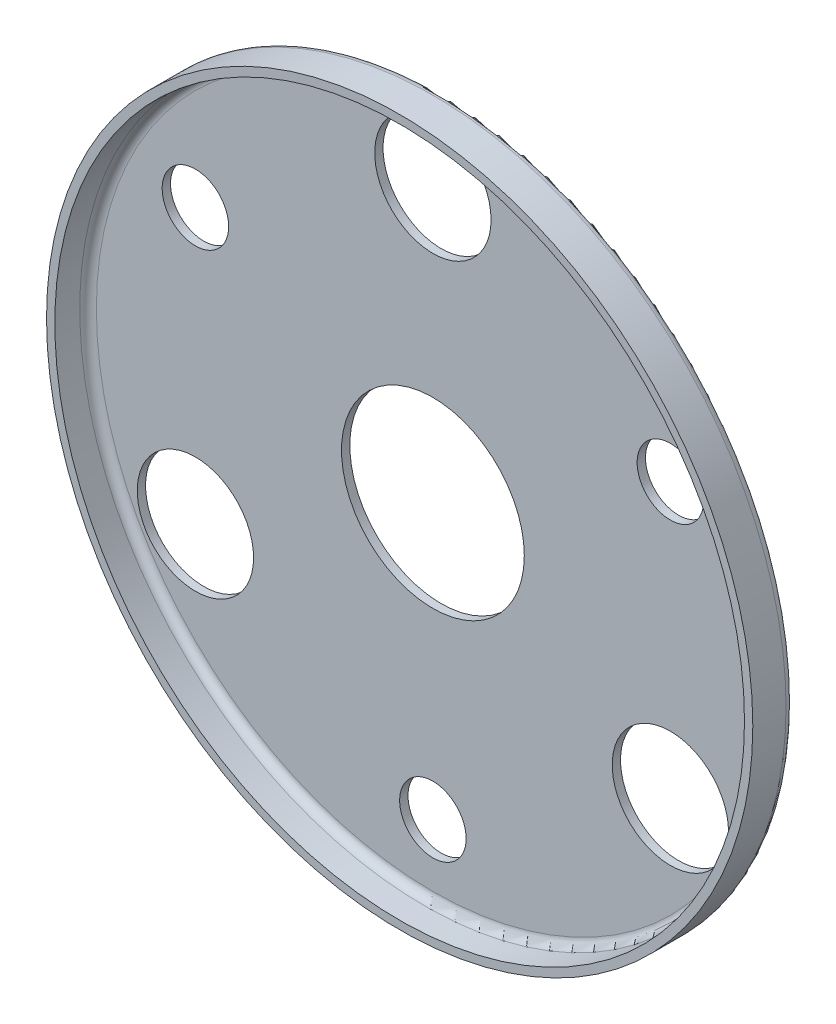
SolidWorks part; units mm, degrees
ref_plane "Plan de face" through (0, 0, 0) normal (0, 0, 1) x (1, 0, 0)
ref_plane "Plan de dessus" through (0, 0, 0) normal (0, 1, 0) x (1, 0, 0)
ref_plane "Plan de droite" through (0, 0, 0) normal (1, 0, 0) x (0, 0, -1)
sketch "Esquisse1" plane through (0, 0, 0) normal (0, 0, 1) x (1, 0, 0)
  circle A0 centre (0, 0) radius 42.5
  dimension "D1" = 85
extrude "Extrusion1" add sketch "Esquisse1" along normal blind 5
sketch "Esquisse2" plane through (0, 0, 5) normal (0, 0, 1) x (1, 0, 0)
  circle A0 centre (0, 0) radius 41.5
  dimension "D1" = 83
extrude "Enlèv. mat.-Extru.1" cut sketch "Esquisse2" against normal blind 4
fillet "Congé1" radius 1 2 edges at (42.5, 0, 0) (41.5, 0, 1)
sketch "Esquisse3" plane through (0, 0, 1) normal (0, 0, 1) x (1, 0, 0)
  circle A0 centre (0, 0) radius 11
  circle A1 centre (0, 33) radius 7
  dimension "D1" = 22
  dimension "D2" = 14
  dimension "D3" = 33
extrude "Enlèv. mat.-Extru.2" cut sketch "Esquisse3" against normal through all
pattern_circular "Répétition circulaire1" count 3 over 360 about axis through (0, 0, 0) along (0, 0, 1) of "Enlèv. mat.-Extru.2"
sketch "Esquisse4" plane through (0, 0, 1) normal (0, 0, 1) x (1, 0, 0)
  circle A0 centre (0, -33) radius 4
  circle A1 centre (0, 0) radius 11 construction
  dimension "D1" = 8
  dimension "D2" = 33
extrude "Enlèv. mat.-Extru.3" cut sketch "Esquisse4" against normal through all
pattern_circular "Répétition circulaire2" count 3 over 360 about axis through (0, 0, 0) along (0, 0, 1) of "Enlèv. mat.-Extru.3"
